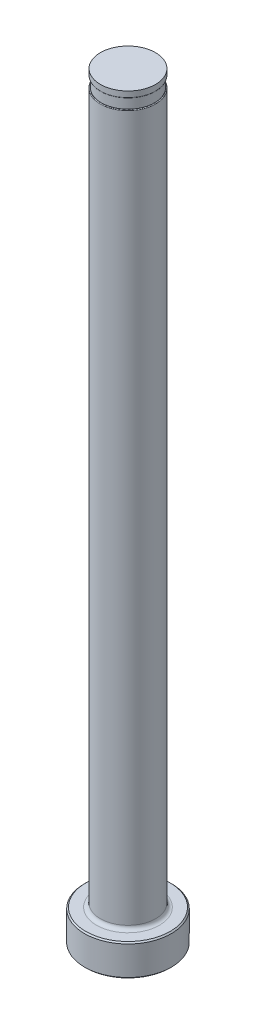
SolidWorks part; units mm, degrees
ref_plane "Front Plane" through (0, 0, 0) normal (0, 0, 1) x (1, 0, 0)
ref_plane "Top Plane" through (0, 0, 0) normal (0, 1, 0) x (1, 0, 0)
ref_plane "Right Plane" through (0, 0, 0) normal (1, 0, 0) x (0, 0, -1)
other "Configuration Table"
sketch "Sketch1" plane through (0, 0, 0) normal (0, 0, 1) x (1, 0, 0)
  line L0 (0, 259.9588) -> (0, -15.1925) construction
  line L1 (0, 0) -> (-8.7249, 0)
  line L2 (-8.7249, 0) -> (-8.7249, 6.35)
  line L3 (-8.7249, 6.35) -> (-5.5562, 6.35)
  line L4 (-5.5562, 6.35) -> (-5.5562, 152.4)
  line L5 (-5.5562, 152.4) -> (0, 152.4)
  line L6 (0, 152.4) -> (0, 0)
  dimension "L" = 152.4
  dimension "H" = 17.4498
  dimension "T" = 6.35
  dimension "D" = 11.1125
revolve "Revolve1" add sketch "Sketch1" angle 360 about L0
chamfer "Chamfer1" distance 0.254 angle 45 2 edges at (0, 6.35, 8.7249) (0, 0, 8.7249)
fillet "Fillet1" radius 0.762 1 edges at (0, 6.35, 5.5562)
sketch "Sketch2" plane through (0, 0, 0) normal (0, 0, 1) x (1, 0, 0)
  line L0 (-5.5562, 152.4) -> (-5.5562, 7.112) construction
  line L1 (-5.5562, 151.13) -> (-5.353, 151.13)
  line L2 (-5.5562, 151.13) -> (-5.5562, 149.098)
  line L3 (-5.5562, 149.098) -> (-5.353, 149.098)
  line L4 (-5.353, 151.13) -> (-5.353, 149.098)
  line L5 (5.5562, 152.4) -> (-5.5562, 152.4) construction
  line L6 (0, 153.4483) -> (0, 147.3282) construction
  dimension "D1" = 2.032
  dimension "N" = 1.27
  dimension "FD" = 0.2032
  dimension "D3" = 10.7061
revolve "Vent Relief" cut sketch "Sketch2" angle 360 about L6
sketch "Sketch3" plane through (0, 0, 0) normal (0, 0, 1) x (1, 0, 0)
  line L0 (-5.353, 150.114) -> (-5.353, 86.614)
  line L1 (-5.353, 151.13) -> (-5.353, 149.098) construction
  line L2 (-5.5562, 149.098) -> (-5.5562, 7.112) construction
  line L3 (-5.5562, 85.4964) -> (-5.5562, 150.114)
  line L4 (-5.5562, 150.114) -> (-5.353, 150.114)
  arc A0 (-5.353, 86.614) -> (-5.5562, 85.4964) centre (-8.528, 86.614) cw
  dimension "D1" = 3.175
  dimension "D2" = 63.5
extrude "D-Slot" cut sketch "Sketch3" against normal through all both and the other way through all
sketch "Sketch5" plane through (0, 0, 0) normal (0, 0, 1) x (1, 0, 0)
  line L0 (-5.5562, 151.13) -> (5.5562, 151.13) construction
  line L1 (-5.5562, 152.4) -> (-5.5435, 152.4)
  line L2 (-5.5562, 152.4) -> (-5.5562, 151.13)
  line L3 (-5.5562, 151.13) -> (-5.5435, 151.13)
  line L4 (-5.5435, 152.4) -> (-5.5435, 151.13)
  line L5 (0, 152.6877) -> (0, 150.5771) construction
  dimension "VP" = 0.0127
revolve "Vent Diameter" cut sketch "Sketch5" angle 360 about L5
fillet "Fillet2" radius 0.127 2 edges at (5.5562, 149.098, 0) (0, 151.13, 5.5435)
sketch "Pocket Sketch" plane through (0, 0, 0) normal (0, 0, 1) x (1, 0, 0)
  line L0 (-9.1218, 0) -> (-9.1218, 6.3754)
  line L1 (-9.1218, 6.3754) -> (-6.5167, 6.3754)
  line L2 (-5.7547, 7.1374) -> (-5.7547, 22.225)
  line L3 (-5.7547, 22.225) -> (0, 22.225)
  line L4 (0, 22.225) -> (0, 0)
  line L5 (0, 0) -> (-9.1218, 0)
  line L6 (0, 12.6104) -> (0, -2.4989) construction
  line L7 (-8.7249, 6.096) -> (-8.7249, 0.254) construction
  line L8 (8.4709, 6.35) -> (-8.4709, 6.35) construction
  line L9 (-5.5562, 85.4964) -> (-5.5562, 7.112) construction
  line L10 (-6.5167, 6.3754) -> (-5.7547, 7.1374)
  point P3 (-5.7547, 6.3754)
  dimension "D1" = 18.2435
  dimension "D2" = 0.3969
  dimension "D3" = 0.0254
  dimension "D4" = 0.1984
  dimension "D5" = 11.5094
  dimension "D6" = 22.225
